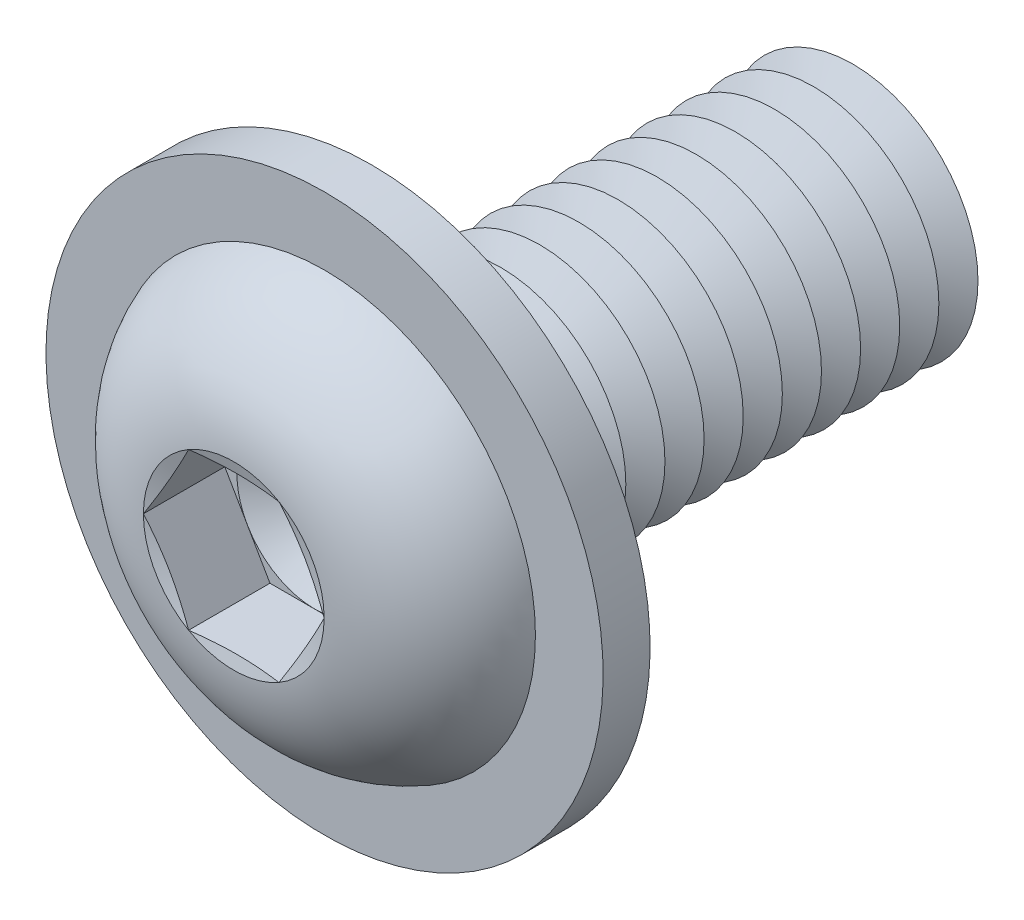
SolidWorks part; units mm, degrees
ref_plane "Front Plane" through (0, 0, 0) normal (0, 0, 1) x (1, 0, 0)
ref_plane "Top Plane" through (0, 0, 0) normal (0, 1, 0) x (1, 0, 0)
ref_plane "Right Plane" through (0, 0, 0) normal (1, 0, 0) x (0, 0, -1)
sketch "Sketch1" plane through (0, 0, 0) normal (1, 0, 0) x (0, 0, -1)
  line L0 (0, 4) -> (0, 7)
  line L3 (0, 4) -> (16, 4)
  line L4 (16, 4) -> (16, 0)
  line L5 (16, 0) -> (-4.4, 0) construction
  line L6 (-4.4, 0) -> (16, 0)
  line L7 (-4.4, 2.8867) -> (-4.4, 1.4434) construction
  line L8 (-4.4, 1.4434) -> (-4.4, 0)
  line L9 (-4.4, 2.8867) -> (-4.0132, 1.4434)
  line L10 (-4.0132, 1.4434) -> (-4.4, 1.4434)
  line L11 (16, 0) -> (22.7481, 0) construction
  line L12 (0, 7) -> (-4.4, 7) construction
  arc A1 (0, 7) -> (-4.4, 2.8867) centre (0, 2.59) ccw
  point P8 (16, 2)
  dimension "D1" = 14
  dimension "D2" = 8
  dimension "D3" = 4.4
  dimension "D4" = 5.7735
  dimension "D5" = 16
  dimension "D6" = 15
revolve "Revolve1" add sketch "Sketch1" angle 360 about L5
fillet "Fillet1" radius 0.625 1 edges at (-4, 0, 0)
sketch "Sketch2" plane through (0, 0, 0) normal (1, 0, 0) x (0, 0, -1)
  line L0 (15.375, 4) -> (16.625, 4)
  line L1 (16, 4) -> (0.625, 4) construction
  line L2 (16.625, 4) -> (16, 2.9175)
  line L3 (16, -4) -> (16, 4) construction
  line L4 (16, 2.9175) -> (15.375, 4)
  dimension "D1" = 1.25
revolve "Cut-Revolve1" cut sketch "Sketch2" angle 360 about axis through (0, 0, -16) along (0, 0, -1)
pattern_linear "LPattern1" count 12 spacing 1.25 along (0, 0, 1) of "Cut-Revolve1"
sketch "Sketch3" plane through (0, 0, 4.4) normal (0, 0, 1) x (1, 0, 0)
  line L7 (1.4434, 2.5) -> (-1.4434, 2.5)
  line L8 (-1.4434, 2.5) -> (-2.8867, 0)
  line L9 (-2.8867, 0) -> (-1.4434, -2.5)
  line L10 (-1.4434, -2.5) -> (1.4434, -2.5)
  line L11 (1.4434, -2.5) -> (2.8867, 0)
  line L12 (2.8867, 0) -> (1.4434, 2.5)
  circle A0 centre (0, 0) radius 2.5 construction
  circle A3 centre (0, 0) radius 2.8867 construction
extrude "Cut-Extrude1" cut sketch "Sketch3" against normal blind 2.6
sketch "Sketch4" plane through (0, 0, 1.8) normal (0, 0, 1) x (1, 0, 0)
  line L1 (1.4434, 2.5) -> (-1.4434, 2.5) construction
  circle A0 centre (0, 0) radius 2.5
extrude "Cut-Extrude2" cut sketch "Sketch4" against normal through all draft 60
sketch "Sketch5" plane through (0, 0, 0) normal (0, 0, -1) x (-1, 0, 0)
  circle A0 centre (0, 0) radius 8.9
  circle A1 centre (0, 0) radius 4.625
  circle A2 centre (0, 0) radius 4.625 construction
  dimension "D1" = 17.8
extrude "Boss-Extrude1" add sketch "Sketch5" against normal blind 1.5
